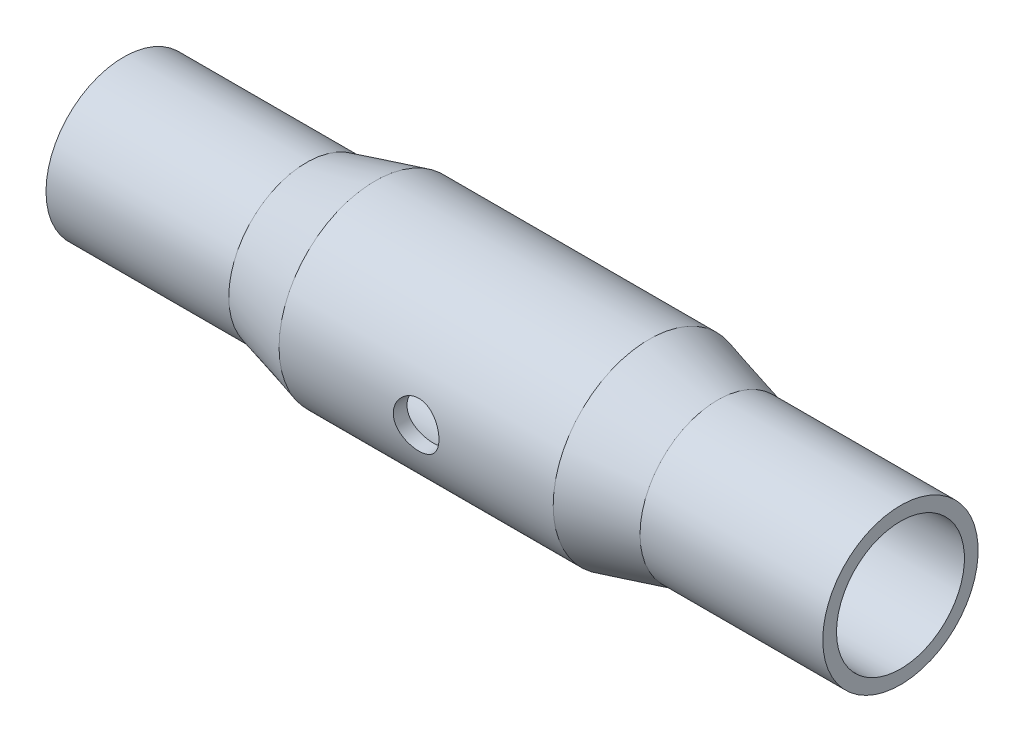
SolidWorks part; units mm, degrees
ref_plane "Plan de face" through (0, 0, 0) normal (0, 0, 1) x (1, 0, 0)
ref_plane "Plan de dessus" through (0, 0, 0) normal (0, 1, 0) x (1, 0, 0)
ref_plane "Plan de droite" through (0, 0, 0) normal (1, 0, 0) x (0, 0, -1)
sketch "Esquisse1" plane through (0, 0, 0) normal (0, 0, 1) x (1, 0, 0)
  line L0 (-91.8957, 0) -> (124.2758, 0) construction
  line L1 (-67.0085, 17) -> (-27.0085, 17)
  line L2 (-27.0085, 17) -> (-12.0085, 21)
  line L3 (-12.0085, 21) -> (47.9915, 21)
  line L4 (47.9915, 21) -> (62.9915, 17)
  line L5 (62.9915, 17) -> (102.9915, 17)
  dimension "D1" = 40
  dimension "D2" = 60
  dimension "D3" = 40
  dimension "D4" = 15
  dimension "D5" = 15
  dimension "D6" = 34
  dimension "D7" = 42
  dimension "D8" = 34
revolve "Révol.-Mince1" add sketch "Esquisse1" angle 360 about L0
sketch "Esquisse2" plane through (0, 0, 0) normal (0, 0, 1) x (1, 0, 0)
  line L0 (-12.0085, 21) -> (-12.0085, -21) construction
  circle A0 centre (17.9915, 0) radius 5
  dimension "D1" = 10
  dimension "D2" = 30
extrude "Enlèv. mat.-Extru.1" cut sketch "Esquisse2" against normal mid plane 60
